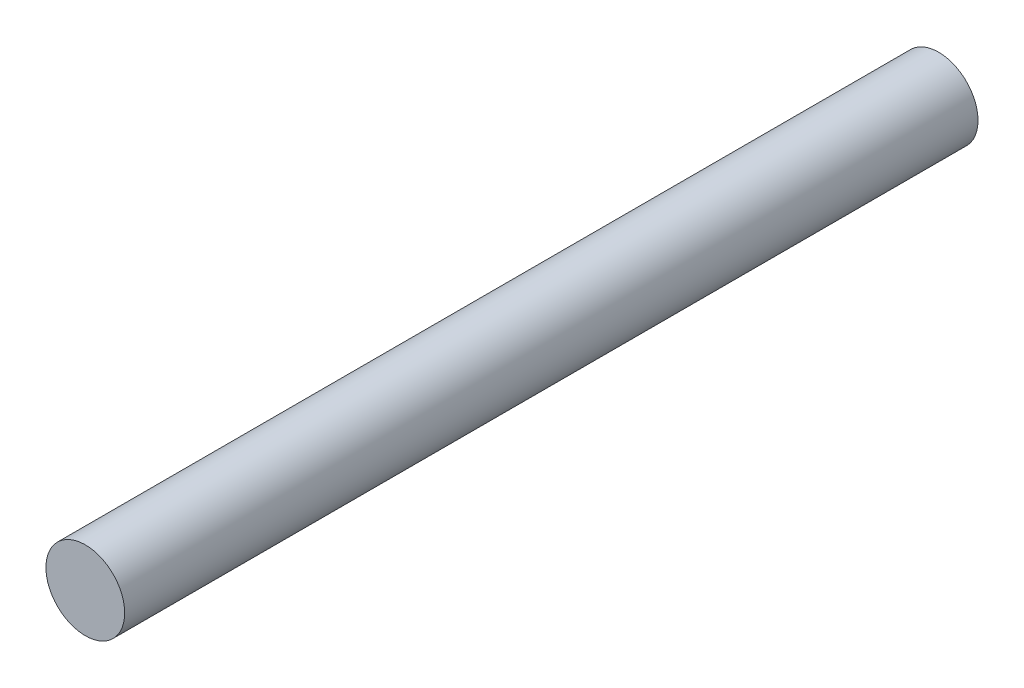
SolidWorks part; units mm, degrees
ref_plane "Front Plane" through (0, 0, 0) normal (0, 0, 1) x (1, 0, 0)
ref_plane "Top Plane" through (0, 0, 0) normal (0, 1, 0) x (1, 0, 0)
ref_plane "Right Plane" through (0, 0, 0) normal (1, 0, 0) x (0, 0, -1)
sketch "Sketch1" plane through (0, 0, 0) normal (0, 0, 1) x (1, 0, 0)
  circle A0 centre (0, 0) radius 30
  dimension "D1" = 60
extrude "Boss-Extrude1" add sketch "Sketch1" against normal blind 650
